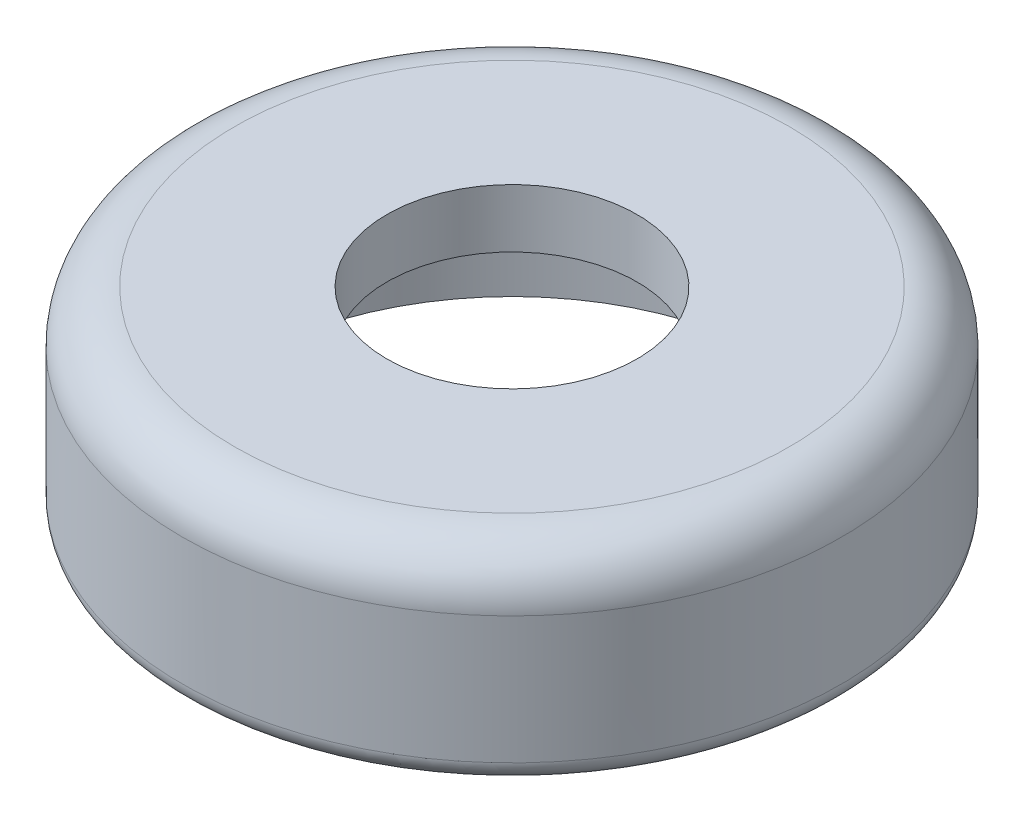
SolidWorks part; units mm, degrees
ref_plane "Front" through (0, 0, 0) normal (0, 0, 1) x (1, 0, 0)
ref_plane "Top" through (0, 0, 0) normal (0, 1, 0) x (1, 0, 0)
ref_plane "Right" through (0, 0, 0) normal (1, 0, 0) x (0, 0, -1)
sketch "Sketch1"
  dimension "D1" = 16.51
  dimension "D2" = 20.066
  dimension "D3" = 6.096
  dimension "D4" = 1.778
  dimension "D5" = 4.826
  dimension "D6" = 8.001
  dimension "D7" = 3.175
revolve "Base-Revolve" add sketch "Sketch1" angle 360 about L1
fillet "Fillet1" radius 1.5875 1 edges at (0, 6.096, -10.033)
sketch "Sketch2"
  dimension "D1" = 7.62
extrude "Cut-Extrude1" cut sketch "Sketch2" against normal through all
fillet "Fillet2" radius 0.635 1 edges at (0, 0, -10.033)
